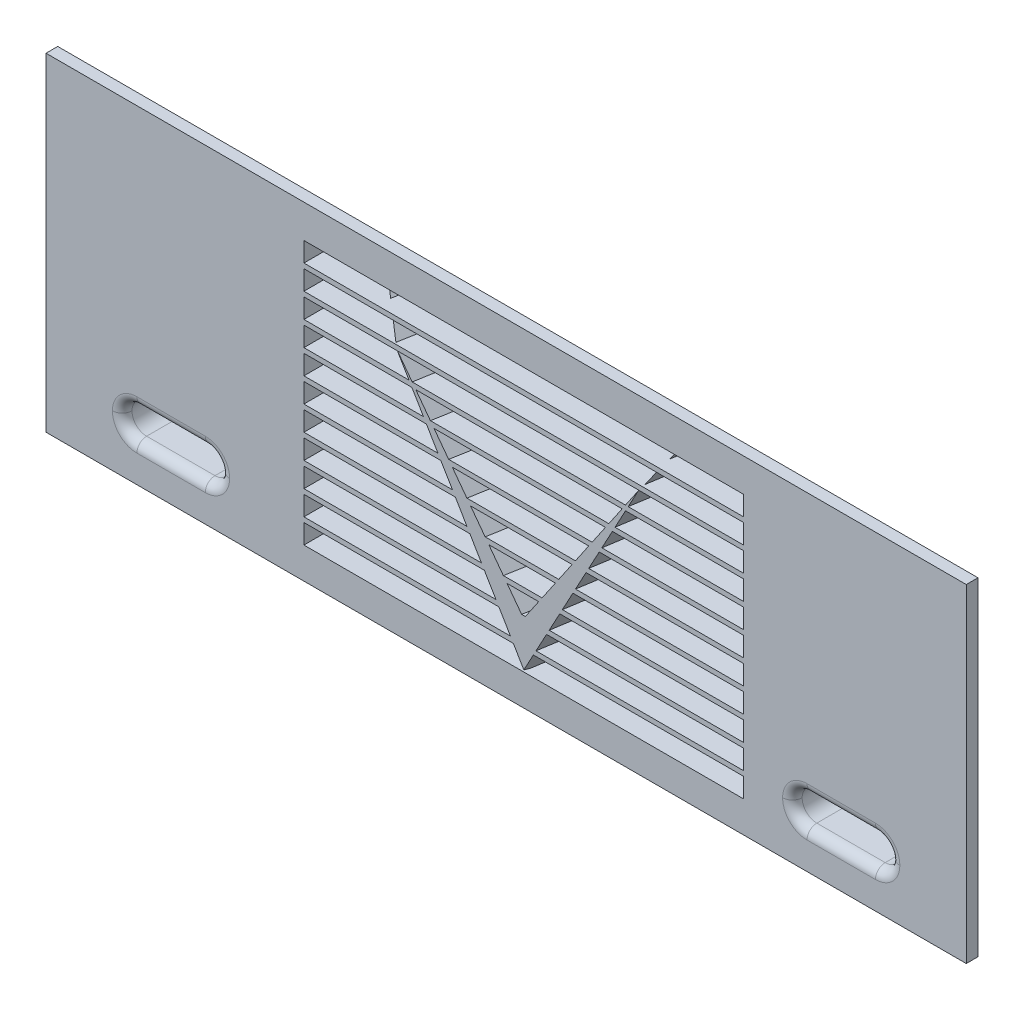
SolidWorks part; units mm, degrees
ref_plane "Спереди" through (0, 0, 0) normal (0, 0, 1) x (1, 0, 0)
ref_plane "Сверху" through (0, 0, 0) normal (0, 1, 0) x (1, 0, 0)
ref_plane "Справа" through (0, 0, 0) normal (1, 0, 0) x (0, 0, -1)
sketch "Эскиз1" plane through (0, 0, 0) normal (0, 0, 1) x (1, 0, 0)
  line L1 (-44.3, 15) -> (44.3, 15)
  line L2 (-44.3, 15) -> (-44.3, -15)
  line L3 (-44.3, -15) -> (44.3, -15)
  line L4 (44.3, 15) -> (44.3, -15)
  line L5 (-44.3, 15) -> (44.3, -15) construction
  line L6 (-44.3, -15) -> (44.3, 15) construction
  point P0 (0, 0)
  dimension "D1" = 88.6
  dimension "D2" = 30
extrude "Бобышка-Вытянуть1" add sketch "Эскиз1" along normal blind 1.2
sketch "Эскиз2" plane through (0, 0, 1.2) normal (0, 0, 1) x (1, 0, 0)
  line L0 (44.3, 15) -> (-44.3, 15) construction
  line L1 (-47.1, 16.8) -> (47.1, 16.8)
  line L2 (-47.1, 16.8) -> (-47.1, -16.8)
  line L3 (-47.1, -16.8) -> (47.1, -16.8)
  line L4 (47.1, 16.8) -> (47.1, -16.8)
  line L5 (-47.1, 16.8) -> (47.1, -16.8) construction
  line L6 (-47.1, -16.8) -> (47.1, 16.8) construction
  line L7 (44.3, -15) -> (44.3, 15) construction
  point P0 (0, 0)
  dimension "D1" = 1.8
  dimension "D2" = 2.8
extrude "Бобышка-Вытянуть2" add sketch "Эскиз2" along normal blind 1.2
sketch "Эскиз5" plane through (0, 0, 0) normal (0, 0, -1) x (-1, 0, 0)
  line L0 (-44.3, -15) -> (-44.3, 15) construction
  line L1 (-24.3, 13.4) -> (20.7, 13.4)
  line L2 (-24.3, 13.4) -> (-24.3, 11.4)
  line L3 (-24.3, 11.4) -> (20.7, 11.4)
  line L4 (20.7, 13.4) -> (20.7, 11.4)
  line L5 (-44.3, 15) -> (44.3, 15) construction
  dimension "D1" = 20
  dimension "D2" = 45
  dimension "D3" = 2
  dimension "D4" = 1.6
extrude "Вырез-Вытянуть1" cut sketch "Эскиз5" against normal through all
pattern_linear "Линейный массив1" count 11 spacing 2.5 along (0, -1, 0) of "Вырез-Вытянуть1"
sketch "Эскиз6" plane through (0, 0, 0) normal (0, 0, -1) x (-1, 0, 0)
  line L5 (-16.8718, 13.8119) -> (-1.8266, -14.0945)
  line L6 (-1.8266, -14.0945) -> (14.7353, 13.8119)
  line L7 (14.7353, 13.8119) -> (-1.7733, -8.287)
  line L8 (-1.7733, -8.287) -> (-16.8718, 13.8119)
extrude "Бобышка-Вытянуть3" add sketch "Эскиз6" against normal through all draft 8
sketch "Эскиз7" plane through (0, 0, 0) normal (0, 0, -1) x (-1, 0, 0)
  line L0 (-44.3, -15) -> (-44.3, 15) construction
  line L1 (-39.3, -10) -> (-29.3, -10)
  line L2 (-39.3, -10) -> (-39.3, -13)
  line L3 (-39.3, -13) -> (-29.3, -13)
  line L4 (-29.3, -10) -> (-29.3, -13)
  line L5 (-39.3, -10) -> (-29.3, -13) construction
  line L6 (-39.3, -13) -> (-29.3, -10) construction
  line L7 (29.3, -10) -> (39.3, -10)
  line L8 (29.3, -10) -> (29.3, -13)
  line L9 (29.3, -13) -> (39.3, -13)
  line L10 (39.3, -10) -> (39.3, -13)
  line L11 (29.3, -10) -> (39.3, -13) construction
  line L12 (29.3, -13) -> (39.3, -10) construction
  line L13 (44.3, -15) -> (-44.3, -15) construction
  line L14 (44.3, 15) -> (44.3, -15) construction
  point P0 (-34.3, -11.5)
  point P5 (34.3, -11.5)
  point P10 (-34.008, -11.11)
  dimension "D1" = 5
  dimension "D2" = 2
  dimension "D3" = 5
  dimension "D4" = 10
  dimension "D5" = 3
extrude "Вырез-Вытянуть2" cut sketch "Эскиз7" against normal up to next
fillet "Скругление2" radius 1.5 8 edges at (39.3, -10, 1.2) (39.3, -13, 1.2) (29.3, -10, 1.2) (29.3, -13, 1.2) (-29.3, -10, 1.2) (-29.3, -13, 1.2) (-39.3, -10, 1.2) (-39.3, -13, 1.2)
sketch "Эскиз8" plane through (0, 0, 0) normal (0, 0, -1) x (-1, 0, 0)
  line L0 (-30.8, -10) -> (-37.8, -10) construction
  line L1 (-37.8, -13) -> (-30.8, -13) construction
  line L2 (-30.8, -10) -> (-37.8, -10)
  line L3 (-37.8, -13) -> (-30.8, -13)
  line L4 (-30.8, -8) -> (-37.8, -8)
  line L5 (-37.8, -15) -> (-30.8, -15)
  line L6 (30.8, -13) -> (37.8, -13) construction
  line L7 (37.8, -10) -> (30.8, -10) construction
  line L8 (30.8, -13) -> (37.8, -13)
  line L9 (37.8, -10) -> (30.8, -10)
  line L10 (30.8, -15) -> (37.8, -15)
  line L11 (37.8, -8) -> (30.8, -8)
  arc A0 (-29.3, -11.5) -> (-30.8, -10) centre (-30.8, -11.5) ccw construction
  arc A1 (-37.8, -10) -> (-39.3, -11.5) centre (-37.8, -11.5) ccw construction
  arc A2 (-39.3, -11.5) -> (-37.8, -13) centre (-37.8, -11.5) ccw construction
  arc A3 (-30.8, -13) -> (-29.3, -11.5) centre (-30.8, -11.5) ccw construction
  arc A4 (-37.8, -10) -> (-39.3, -11.5) centre (-37.8, -11.5) ccw
  arc A5 (-39.3, -11.5) -> (-37.8, -13) centre (-37.8, -11.5) ccw
  arc A6 (-30.8, -13) -> (-29.3, -11.5) centre (-30.8, -11.5) ccw
  arc A7 (-29.3, -11.5) -> (-30.8, -10) centre (-30.8, -11.5) ccw
  arc A8 (-37.8, -8) -> (-41.3, -11.5) centre (-37.8, -11.5) ccw
  arc A9 (-41.3, -11.5) -> (-37.8, -15) centre (-37.8, -11.5) ccw
  arc A10 (-30.8, -15) -> (-27.3, -11.5) centre (-30.8, -11.5) ccw
  arc A11 (-27.3, -11.5) -> (-30.8, -8) centre (-30.8, -11.5) ccw
  arc A12 (29.3, -11.5) -> (30.8, -13) centre (30.8, -11.5) ccw construction
  arc A13 (30.8, -10) -> (29.3, -11.5) centre (30.8, -11.5) ccw construction
  arc A14 (37.8, -13) -> (39.3, -11.5) centre (37.8, -11.5) ccw construction
  arc A15 (39.3, -11.5) -> (37.8, -10) centre (37.8, -11.5) ccw construction
  arc A16 (29.3, -11.5) -> (30.8, -13) centre (30.8, -11.5) ccw
  arc A17 (30.8, -10) -> (29.3, -11.5) centre (30.8, -11.5) ccw
  arc A18 (37.8, -13) -> (39.3, -11.5) centre (37.8, -11.5) ccw
  arc A19 (39.3, -11.5) -> (37.8, -10) centre (37.8, -11.5) ccw
  arc A20 (37.8, -15) -> (41.3, -11.5) centre (37.8, -11.5) ccw
  arc A21 (41.3, -11.5) -> (37.8, -8) centre (37.8, -11.5) ccw
  arc A22 (30.8, -8) -> (27.3, -11.5) centre (30.8, -11.5) ccw
  arc A23 (27.3, -11.5) -> (30.8, -15) centre (30.8, -11.5) ccw
  dimension "D1" = 2
  dimension "D2" = 2
extrude "Бобышка-Вытянуть5" add sketch "Эскиз8" along normal blind 3
fillet "Скругление5" radius 1 22 edges at (-41.3, -11.5, 0) (-27.3, -11.5, 0) (-39.3, -11.5, -3) (-34.3, -10, -3) (-29.3, -11.5, -3) (-34.3, -13, -3) (-34.3, -8, -3) (-41.3, -11.5, -3) (-34.3, -15, -3) (-27.3, -11.5, -3) (-34.3, -8, 0) (27.3, -11.5, 0) (34.3, -8, 0) (34.3, -13, -3) (29.3, -11.5, -3) (34.3, -10, -3) (39.3, -11.5, -3) (34.3, -15, -3) (41.3, -11.5, -3) (34.3, -8, -3) (27.3, -11.5, -3) (41.3, -11.5, 0)
fillet "Скругление6" radius 1 12 edges at (34.3, -10, 2.4) (34.3, -13, 2.4) (-34.3, -10, 2.4) (-34.3, -13, 2.4) (38.8607, -10.4393, 2.4) (38.8607, -12.5607, 2.4) (29.7393, -10.4393, 2.4) (29.7393, -12.5607, 2.4) (-29.7393, -10.4393, 2.4) (-29.7393, -12.5607, 2.4) (-38.8607, -10.4393, 2.4) (-38.8607, -12.5607, 2.4)
